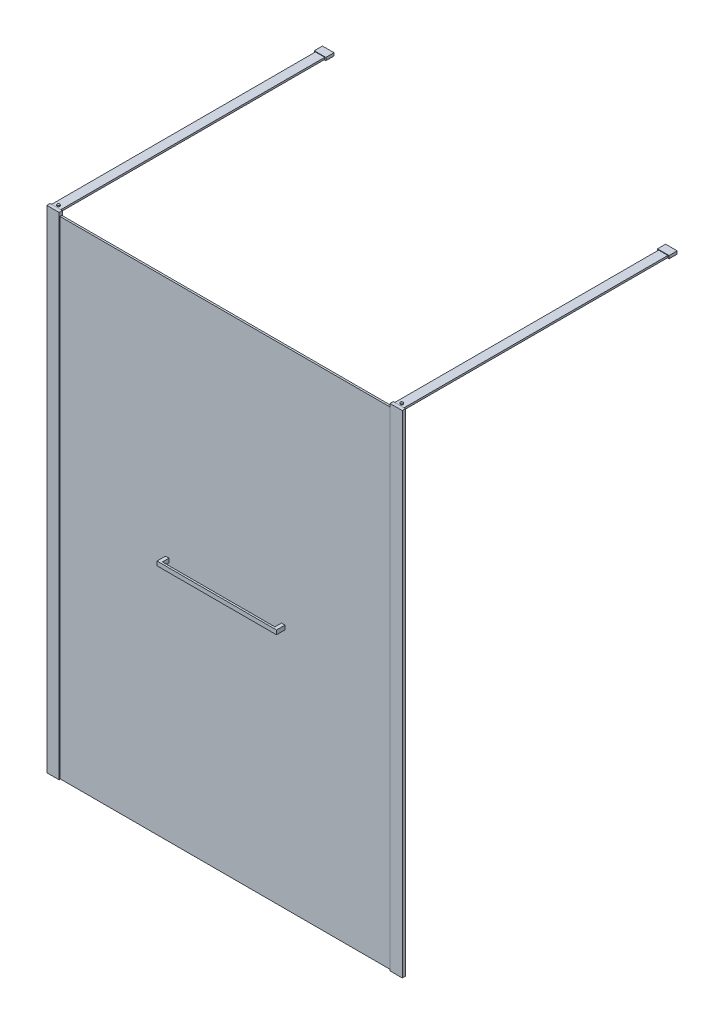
SolidWorks part; units mm, degrees
ref_plane "Płaszczyzna przednia" through (0, 0, 0) normal (0, 0, 1) x (1, 0, 0)
ref_plane "Płaszczyzna górna" through (0, 0, 0) normal (0, 1, 0) x (1, 0, 0)
ref_plane "Płaszczyzna prawa" through (0, 0, 0) normal (1, 0, 0) x (0, 0, -1)
sketch "Szkic1" plane through (0, 0, 0) normal (0, 1, 0) x (1, 0, 0)
  line L0 (0, 0) -> (0, 14)
  line L1 (0, 14) -> (53, 14)
  line L2 (53, 14) -> (53, 11)
  line L3 (53, 11) -> (42.9, 11)
  line L4 (42.9, 11) -> (42.9, 3)
  line L5 (42.9, 3) -> (53, 3)
  line L6 (53, 3) -> (53, 0)
  line L7 (53, 0) -> (0, 0)
  dimension "D1" = 53
  dimension "D2" = 14
  dimension "D3" = 10.1
  dimension "D5" = 8
extrude "Dodanie-wyciągnięcie1" add sketch "Szkic1" along normal blind 2100 from offset 3
sketch "Szkic2" plane through (0, 3, 0) normal (0, -1, 0) x (1, 0, 0)
  line L0 (42.9, -11) -> (53, -11) construction
  line L1 (42.9, -3) -> (1489.9, -3)
  line L2 (42.9, -3) -> (42.9, -11)
  line L3 (42.9, -11) -> (1489.9, -11)
  line L4 (1489.9, -3) -> (1489.9, -11)
  dimension "D1" = 1447
extrude "Dodanie-wyciągnięcie2" add sketch "Szkic2" against normal blind 2100 separate body
sketch "Szkic3" plane through (0, 3, 0) normal (0, -1, 0) x (1, 0, 0)
  line L0 (1479.8, -3) -> (1479.8, 0)
  line L1 (1489.9, -3) -> (42.9, -3) construction
  line L2 (1479.8, 0) -> (1532.8, 0)
  line L3 (1532.8, 0) -> (1532.8, -14)
  line L4 (1532.8, -14) -> (1479.8, -14)
  line L5 (1479.8, -14) -> (1479.8, -11)
  line L6 (1479.8, -11) -> (1489.9, -11)
  line L7 (1489.9, -11) -> (1489.9, -3)
  line L8 (1489.9, -3) -> (1479.8, -3)
  line L9 (42.9, -11) -> (1489.9, -11) construction
  line L10 (1489.9, -11) -> (1489.9, -3) construction
  dimension "D1" = 10.1
  dimension "D2" = 14
  dimension "D4" = 53
extrude "Dodanie-wyciągnięcie3" add sketch "Szkic3" against normal blind 2100 separate body
sketch "Szkic4" plane through (0, 2103, 0) normal (0, 1, 0) x (1, 0, 0)
  line L1 (0, 14) -> (53, 14)
  line L2 (0, 14) -> (0, 0)
  line L3 (0, 0) -> (53, 0)
  line L4 (53, 14) -> (53, 0)
extrude "Dodanie-wyciągnięcie4" add sketch "Szkic4" along normal blind 16
sketch "Szkic5" plane through (0, 2103, 0) normal (0, 1, 0) x (1, 0, 0)
  line L1 (1532.8, 14) -> (1479.8, 14)
  line L2 (1532.8, 14) -> (1532.8, 0)
  line L3 (1532.8, 0) -> (1479.8, 0)
  line L4 (1479.8, 14) -> (1479.8, 0)
extrude "Dodanie-wyciągnięcie5" add sketch "Szkic5" along normal blind 16
sketch "Szkic7" plane through (0, 3, 0) normal (0, -1, 0) x (1, 0, 0)
  line L1 (1479.8, 0) -> (1532.8, 0)
  line L2 (1479.8, 0) -> (1479.8, -14)
  line L3 (1479.8, -14) -> (1532.8, -14)
  line L4 (1532.8, 0) -> (1532.8, -14)
extrude "Dodanie-wyciągnięcie7" add sketch "Szkic7" along normal blind 3
sketch "Szkic8" plane through (0, 3, 0) normal (0, -1, 0) x (1, 0, 0)
  line L1 (0, 0) -> (53, 0)
  line L2 (0, 0) -> (0, -14)
  line L3 (0, -14) -> (53, -14)
  line L4 (53, 0) -> (53, -14)
extrude "Dodanie-wyciągnięcie8" add sketch "Szkic8" along normal blind 3
sketch "Szkic9" plane through (0, 0, -14) normal (0, 0, -1) x (-1, 0, 0)
  line L0 (-1532.8, 2119) -> (-1479.8, 2119) construction
  line L1 (-1526.3, 2119) -> (-1486.3, 2119)
  line L2 (-1526.3, 2119) -> (-1526.3, 2111)
  line L3 (-1526.3, 2111) -> (-1486.3, 2111)
  line L4 (-1486.3, 2119) -> (-1486.3, 2111)
  line L5 (-1532.8, 2119) -> (-1532.8, 0) construction
  line L6 (-1479.8, 2119) -> (-1479.8, 0) construction
  line L7 (-53, 2119) -> (-53, 0) construction
  line L8 (-46.5, 2119) -> (-6.5, 2119)
  line L9 (-46.5, 2119) -> (-46.5, 2111)
  line L10 (-46.5, 2111) -> (-6.5, 2111)
  line L11 (-6.5, 2119) -> (-6.5, 2111)
  line L12 (0, 2119) -> (0, 0) construction
  line L13 (-53, 2119) -> (0, 2119) construction
  dimension "D1" = 6.5
  dimension "D2" = 6.5
  dimension "D3" = 8
  dimension "D4" = 6.5
  dimension "D5" = 6.5
  dimension "D6" = 8
extrude "Dodanie-wyciągnięcie9" add sketch "Szkic9" along normal blind 1170 separate body
sketch "Szkic10" plane through (0, 0, -1184) normal (0, 0, -1) x (-1, 0, 0)
  line L0 (-1506.3, 2119) -> (-1506.3, 2115) construction
  line L1 (-1531.3, 2121.25) -> (-1481.3, 2121.25)
  line L2 (-1531.3, 2121.25) -> (-1531.3, 2108.75)
  line L3 (-1531.3, 2108.75) -> (-1481.3, 2108.75)
  line L4 (-1481.3, 2121.25) -> (-1481.3, 2108.75)
  line L5 (-1531.3, 2121.25) -> (-1481.3, 2108.75) construction
  line L6 (-1531.3, 2108.75) -> (-1481.3, 2121.25) construction
  line L7 (-1486.3, 2119) -> (-1526.3, 2119) construction
  line L8 (-1506.3, 2115) -> (-1526.3, 2115) construction
  line L9 (-1526.3, 2119) -> (-1526.3, 2111) construction
  line L10 (-26.5, 2119) -> (-26.5, 2115) construction
  line L11 (-51.5, 2121.25) -> (-1.5, 2121.25)
  line L12 (-51.5, 2121.25) -> (-51.5, 2108.75)
  line L13 (-51.5, 2108.75) -> (-1.5, 2108.75)
  line L14 (-1.5, 2121.25) -> (-1.5, 2108.75)
  line L15 (-51.5, 2121.25) -> (-1.5, 2108.75) construction
  line L16 (-51.5, 2108.75) -> (-1.5, 2121.25) construction
  line L17 (-6.5, 2119) -> (-46.5, 2119) construction
  line L18 (-26.5, 2115) -> (-46.5, 2115) construction
  line L19 (-46.5, 2119) -> (-46.5, 2111) construction
  point P0 (-1506.3, 2115)
  point P9 (-26.5, 2115)
  dimension "D1" = 12.5
  dimension "D2" = 50
  dimension "D3" = 12.5
  dimension "D4" = 50
extrude "Dodanie-wyciągnięcie10" add sketch "Szkic10" along normal blind 35 from offset 32
ref_plane "Płaszczyzna1" through (1506.3, 0, 0) normal (1, 0, 0) x (0, 0, -1)
sketch "Szkic11" plane through (1506.3, 0, 0) normal (1, 0, 0) x (0, 0, -1)
  line L0 (24, 2119) -> (24, 2127.4416) construction
  line L1 (24, 2119) -> (34.6926, 2119) construction
  line L2 (29.9, 2119) -> (29.65, 2122.8)
  line L3 (24, 2124.7) -> (30.2413, 2124.7) construction
  line L4 (24, 2124.7) -> (24, 2124.2)
  line L5 (1152, 2119) -> (14, 2119) construction
  line L6 (14, 2119) -> (14, 2111) construction
  line L7 (29.3989, 2119) -> (29.9, 2119)
  line L9 (29.1663, 2122.5357) -> (29.3989, 2119)
  arc A0 (24, 2124.7) -> (29.65, 2122.8) centre (24, 2115.3493) cw
  arc A1 (29.1663, 2122.5357) -> (24, 2124.2) centre (24, 2115.3493) ccw
  dimension "D1" = 0.5
  dimension "D2" = 11.3
  dimension "D3" = 5.7
  dimension "D4" = 3.8
  dimension "D5" = 11.8
  dimension "D6" = 0.5
  dimension "D7" = 10
revolve "Obrót1" add sketch "Szkic11" angle 360 about L0
ref_plane "Płaszczyzna2" through (26.5, 0, 0) normal (1, 0, 0) x (0, 0, -1)
sketch "Szkic14" plane through (26.5, 0, 0) normal (1, 0, 0) x (0, 0, -1)
  line L0 (24, 2119) -> (24, 2141.8878) construction
  line L1 (24, 2119) -> (23.0807, 2119) construction
  line L2 (29.9, 2119) -> (29.65, 2122.8)
  line L3 (24, 2124.7) -> (18.6294, 2124.7) construction
  line L4 (24, 2124.7) -> (24, 2124.2)
  line L5 (29.3989, 2119) -> (29.9, 2119)
  line L6 (29.1663, 2122.5357) -> (29.3989, 2119)
  line L7 (1152, 2119) -> (14, 2119) construction
  line L8 (14, 2119) -> (14, 2111) construction
  arc A0 (24, 2124.7) -> (29.65, 2122.8) centre (24, 2115.3493) cw
  arc A1 (29.1663, 2122.5357) -> (24, 2124.2) centre (24, 2115.3493) ccw
  dimension "D1" = 5.7
  dimension "D2" = 3.8
  dimension "D3" = 0.5
  dimension "D4" = 0.5
  dimension "D5" = 11.3
  dimension "D6" = 11.8
  dimension "D7" = 10
revolve "Obrót2" add sketch "Szkic14" angle 360 about L0
sketch "Szkic12" plane through (0, 0, -3) normal (0, 0, 1) x (1, 0, 0)
  line L0 (766.4, 1409.7928) -> (766.4, 762.3594) construction
  line L1 (516.4, 1053) -> (1016.4, 1053) construction
  line L2 (42.9, 2103) -> (42.9, 3) construction
  line L3 (1489.9, 2103) -> (1489.9, 3) construction
  line L5 (508.9, 1062) -> (523.9, 1062)
  line L6 (508.9, 1062) -> (508.9, 1044)
  line L7 (508.9, 1044) -> (523.9, 1044)
  line L8 (523.9, 1062) -> (523.9, 1044)
  line L9 (508.9, 1062) -> (523.9, 1044) construction
  line L10 (508.9, 1044) -> (523.9, 1062) construction
  line L11 (1008.9, 1062) -> (1023.9, 1062)
  line L12 (1008.9, 1062) -> (1008.9, 1044)
  line L13 (1008.9, 1044) -> (1023.9, 1044)
  line L14 (1023.9, 1062) -> (1023.9, 1044)
  line L15 (1008.9, 1062) -> (1023.9, 1044) construction
  line L16 (1008.9, 1044) -> (1023.9, 1062) construction
  dimension "D1" = 1053
  dimension "D2" = 500
  dimension "D3" = 15
  dimension "D4" = 18
extrude "Dodanie-wyciągnięcie11" add sketch "Szkic12" along normal blind 36.5 and the other way blind 18 separate body
sketch "Szkic13" plane through (523.9, 0, 0) normal (1, 0, 0) x (0, 0, -1)
  line L0 (21, 1044) -> (-33.5, 1044) construction
  line L1 (-33.5, 1062) -> (-25.5, 1062)
  line L2 (-33.5, 1062) -> (-33.5, 1044)
  line L3 (-33.5, 1044) -> (-25.5, 1044)
  line L4 (-25.5, 1062) -> (-25.5, 1044)
  dimension "D1" = 8
extrude "Dodanie-wyciągnięcie12" add sketch "Szkic13" along normal up to surface (485 mm away)
